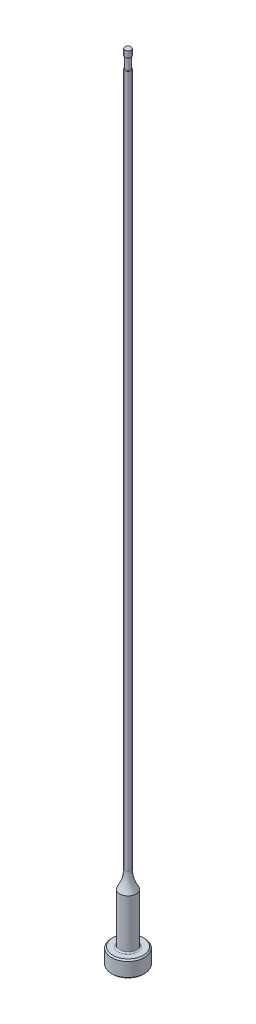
SolidWorks part; units mm, degrees
ref_plane "Front Plane" through (0, 0, 0) normal (0, 0, 1) x (1, 0, 0)
ref_plane "Top Plane" through (0, 0, 0) normal (0, 1, 0) x (1, 0, 0)
ref_plane "Right Plane" through (0, 0, 0) normal (1, 0, 0) x (0, 0, -1)
other "Configuration Table"
sketch "Sketch1" plane through (0, 0, 0) normal (0, 0, 1) x (1, 0, 0)
  line L0 (0, 259.9588) -> (0, -15.1925) construction
  line L1 (0, 0) -> (-3.175, 0)
  line L2 (-3.175, 0) -> (-3.175, 3.175)
  line L3 (-3.175, 3.175) -> (-1.5875, 3.175)
  line L4 (-0.5944, 16.1098) -> (-0.5944, 152.4)
  line L5 (-0.5944, 152.4) -> (0, 152.4)
  line L6 (0, 152.4) -> (0, 0)
  line L7 (-1.5875, 3.175) -> (-1.5875, 12.7)
  arc A1 (-1.5875, 12.7) -> (-0.5944, 16.1098) centre (-6.9444, 16.1098) ccw
  dimension "D1" = 6.35
  dimension "L" = 152.4
  dimension "D2" = 3.175
  dimension "H" = 6.35
  dimension "T" = 3.175
  dimension "D" = 1.1887
  dimension "S" = 12.7
revolve "Revolve1" add sketch "Sketch1" angle 360 about L0
chamfer "Chamfer1" distance 0.254 angle 45 2 edges at (0, 3.175, 3.175) (0, 0, 3.175)
fillet "Fillet1" radius 0.254 1 edges at (0, 3.175, 1.5875)
sketch "Sketch2" plane through (0, 0, 0) normal (0, 0, 1) x (1, 0, 0)
  line L0 (-0.5944, 152.4) -> (-0.5944, 16.1098) construction
  line L1 (-0.5944, 151.13) -> (-0.4928, 151.13)
  line L2 (-0.5944, 151.13) -> (-0.5944, 149.098)
  line L3 (-0.5944, 149.098) -> (-0.4928, 149.098)
  line L4 (-0.4928, 151.13) -> (-0.4928, 149.098)
  line L5 (0.5944, 152.4) -> (-0.5944, 152.4) construction
  line L6 (0, 153.4483) -> (0, 147.3282) construction
  dimension "D1" = 2.032
  dimension "N" = 1.27
  dimension "FD" = 0.1016
  dimension "D3" = 0.9855
revolve "Vent Relief" cut sketch "Sketch2" angle 360 about L6
sketch "Sketch3" plane through (0, 0, 0) normal (0, 0, 1) x (1, 0, 0)
  line L0 (-0.4928, 150.114) -> (-0.4928, 112.014)
  line L1 (-0.4928, 151.13) -> (-0.4928, 149.098) construction
  line L2 (-0.5944, 149.098) -> (-0.5944, 16.1098) construction
  line L3 (-0.5944, 111.2172) -> (-0.5944, 150.114)
  line L4 (-0.5944, 150.114) -> (-0.4928, 150.114)
  arc A0 (-0.4928, 112.014) -> (-0.5944, 111.2172) centre (-3.6678, 112.014) cw
  dimension "D1" = 3.175
  dimension "D2" = 38.1
extrude "D-Slot" cut sketch "Sketch3" against normal through all both and the other way through all
sketch "Sketch5" plane through (0, 0, 0) normal (0, 0, 1) x (1, 0, 0)
  line L0 (-0.5944, 151.13) -> (0.5944, 151.13) construction
  line L1 (-0.5944, 152.4) -> (-0.5817, 152.4)
  line L2 (-0.5944, 152.4) -> (-0.5944, 151.13)
  line L3 (-0.5944, 151.13) -> (-0.5817, 151.13)
  line L4 (-0.5817, 152.4) -> (-0.5817, 151.13)
  line L5 (0, 152.6877) -> (0, 150.5771) construction
  dimension "VP" = 0.0127
revolve "Vent Diameter" cut sketch "Sketch5" angle 360 about L5
fillet "Fillet2" radius 0.127 2 edges at (0.5944, 149.098, 0) (0, 151.13, 0.5817)
sketch "Pocket Sketch" plane through (0, 0, 0) normal (0, 0, 1) x (1, 0, 0)
  line L0 (-3.5719, 0) -> (-3.5719, 3.2004)
  line L1 (-3.5719, 3.2004) -> (-1.5548, 3.2004)
  line L2 (-0.7928, 3.9624) -> (-0.7928, 22.225)
  line L3 (-0.7928, 22.225) -> (0, 22.225)
  line L4 (0, 22.225) -> (0, 0)
  line L5 (0, 0) -> (-3.5719, 0)
  line L6 (0, 12.6104) -> (0, -2.4989) construction
  line L7 (-3.175, 2.921) -> (-3.175, 0.254) construction
  line L8 (2.921, 3.175) -> (-2.921, 3.175) construction
  line L9 (-0.5944, 111.2172) -> (-0.5944, 16.1098) construction
  line L10 (-1.5548, 3.2004) -> (-0.7928, 3.9624)
  point P3 (-0.7928, 3.2004)
  dimension "D1" = 7.1437
  dimension "D2" = 0.3969
  dimension "D3" = 0.0254
  dimension "D4" = 0.1984
  dimension "D5" = 1.5856
  dimension "D6" = 22.225
